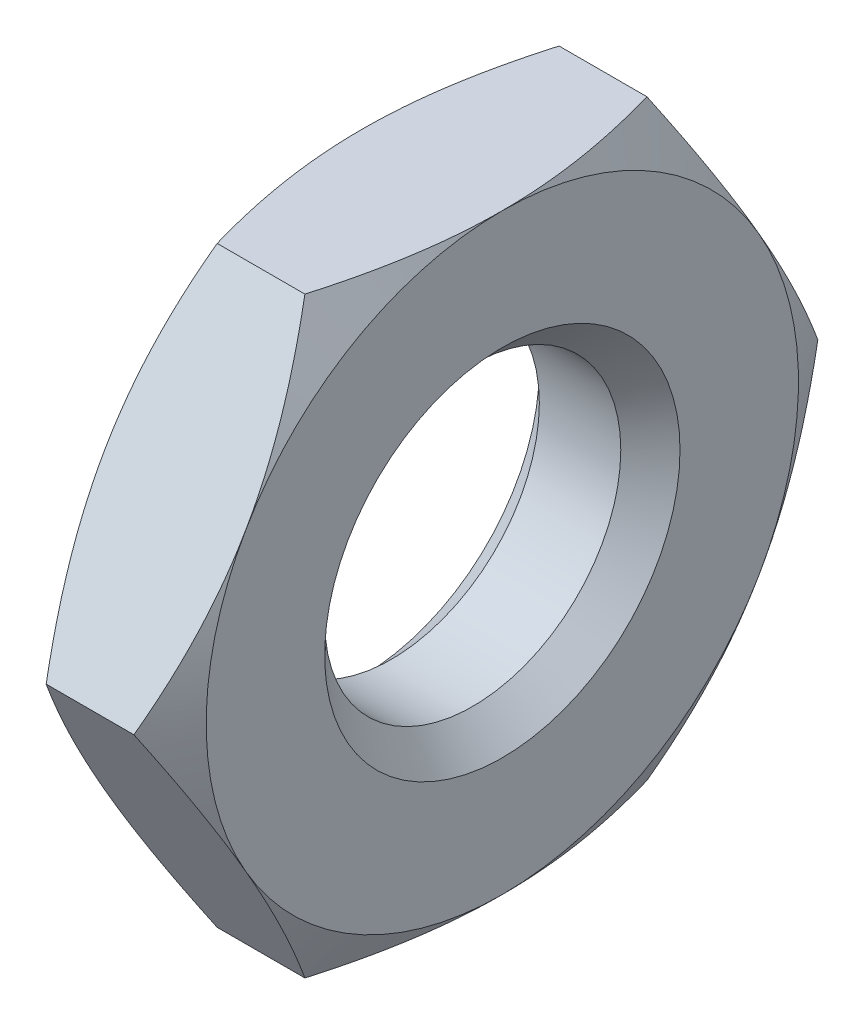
SolidWorks part; units mm, degrees
ref_plane "Front Plane" through (0, 0, 0) normal (0, 0, 1) x (1, 0, 0)
ref_plane "Top Plane" through (0, 0, 0) normal (0, 1, 0) x (1, 0, 0)
ref_plane "Right Plane" through (0, 0, 0) normal (1, 0, 0) x (0, 0, -1)
sketch "Sketch1" plane through (0, 0, 0) normal (1, 0, 0) x (0, 0, -1)
  line L1 (1.1547, 2) -> (-1.1547, 2)
  line L2 (-1.1547, 2) -> (-2.3094, 0)
  line L3 (-2.3094, 0) -> (-1.1547, -2)
  line L4 (-1.1547, -2) -> (1.1547, -2)
  line L5 (1.1547, -2) -> (2.3094, 0)
  line L6 (2.3094, 0) -> (1.1547, 2)
  circle A0 centre (0, 0) radius 2 construction
  circle A1 centre (0, 0) radius 1
extrude "Extrude1" add sketch "Sketch1" along normal blind 0.95
sketch "Sketch2" plane through (0, 0, 0) normal (0, 0, 1) x (1, 0, 0)
  line L0 (0.95, 2) -> (0.95, 8)
  line L1 (0.95, 8) -> (0, 8)
  line L2 (0, 8) -> (0, 2)
  line L3 (0, 2) -> (0.475, 2.8227)
  line L4 (0.475, 2.8227) -> (0.95, 2)
revolve "Cut-Revolve1" cut sketch "Sketch2" angle 360 about axis through (0.95, 0, 0) along (-1, 0, 0)
chamfer "Chamfer1" distance 0.2 angle 45 2 edges at (0, 0, -1) (0.95, 0, -1)
equation "\"D2@Sketch2\"=\"D1@Sketch1\"*2"
